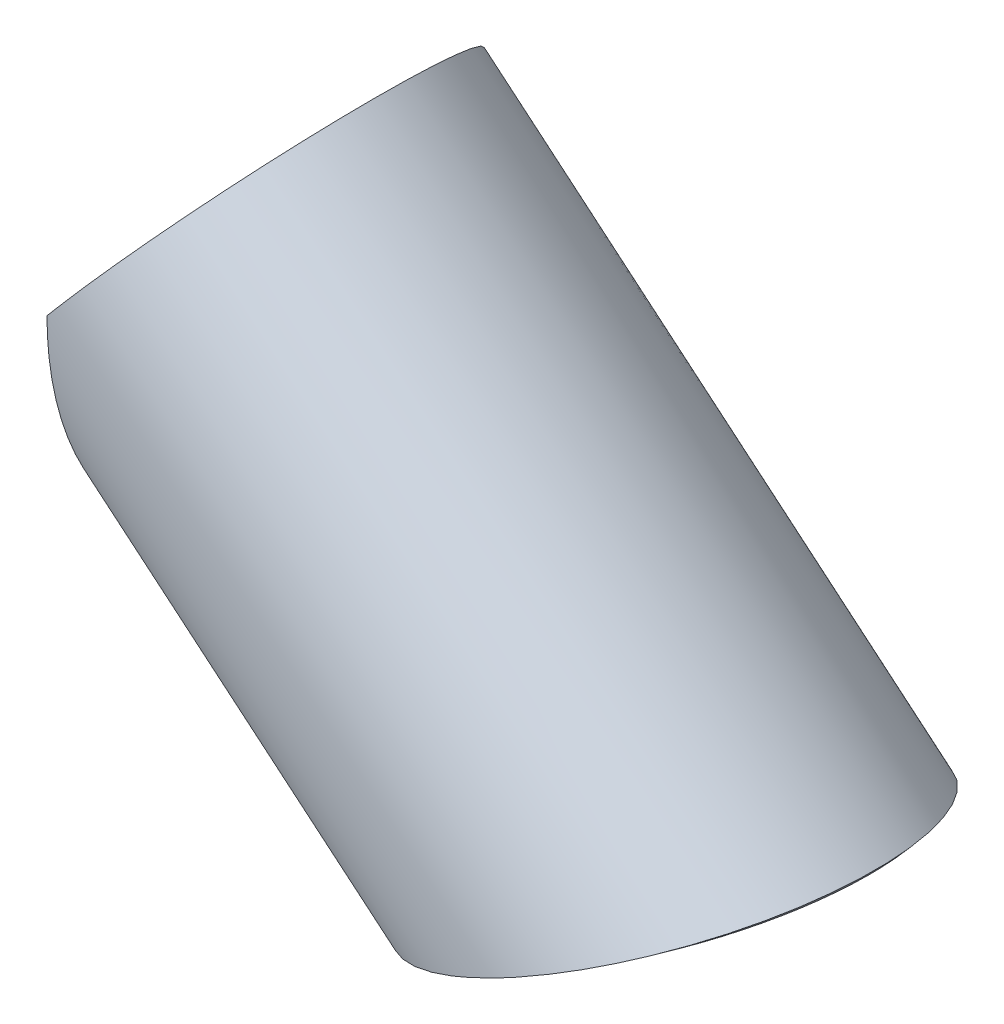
SolidWorks part; units mm, degrees
ref_plane "前视基准面" through (0, 0, 0) normal (0, 0, 1) x (1, 0, 0)
ref_plane "上视基准面" through (0, 0, 0) normal (0, 1, 0) x (1, 0, 0)
ref_plane "右视基准面" through (0, 0, 0) normal (1, 0, 0) x (0, 0, -1)
imported_body "基体零件-等径裤形管-1"
sheet metal parameters "钣金1" parameters "D1"=0.7366, "厚度"=6
bend "圆角折弯1" bend radius 134 bend angle 359.591 parameters "D5"=1
flatten bends "展开-折弯1"
sketch "尖角-草图1" plane through (80.0004, -249.8842, -0.5) normal (-0.6428, -0.766, -0.0036) x (0.766, -0.6428, -0.003)
  line L0 (105.6928, -420.18) -> (-103.1726, -420.8059) construction
  dimension "D1" = 0
process bends "加工-折弯1" parameters "D1"=0
sketch "平面-草图1" plane through (80.0004, -249.8842, -0.5) normal (-0.6428, -0.766, -0.0036) x (0.766, -0.6428, -0.003)
